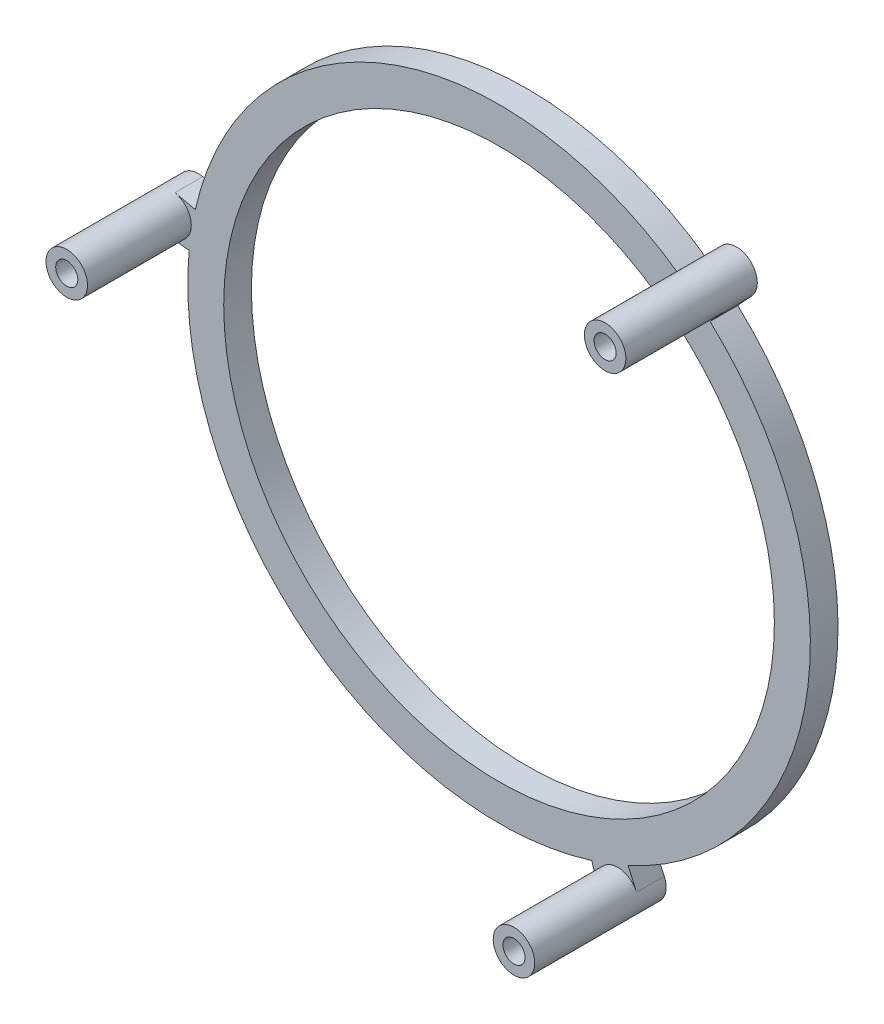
SolidWorks part; units mm, degrees
ref_plane "Front Plane" through (0, 0, 0) normal (0, 0, 1) x (1, 0, 0)
ref_plane "Top Plane" through (0, 0, 0) normal (0, 1, 0) x (1, 0, 0)
ref_plane "Right Plane" through (0, 0, 0) normal (1, 0, 0) x (0, 0, -1)
sketch "Sketch1" plane through (0, 0, 0) normal (0, 0, 1) x (1, 0, 0)
  line L0 (-18.7647, 19.2311) -> (-20.6233, 19.6491)
  line L1 (-19.3285, 15.711) -> (-21.2247, 15.8944)
  line L2 (25.7168, 36.2175) -> (26.8236, 37.768)
  line L3 (28.4833, 33.9693) -> (29.7746, 35.3698)
  line L4 (17.6229, -14.3178) -> (18.1902, -16.1364)
  line L5 (20.9533, -13.0461) -> (21.7426, -14.7799)
  circle A0 centre (9.1138, 12.9608) radius 28.575
  circle A1 centre (9.1138, 12.9608) radius 25.273
  arc A2 (-20.6233, 19.6491) -> (-21.2247, 15.8944) centre (-21.0413, 17.7905) ccw
  arc A3 (26.8236, 37.768) -> (29.7746, 35.3698) centre (28.3741, 36.6611) cw
  arc A4 (18.1902, -16.1364) -> (21.7426, -14.7799) centre (20.0088, -15.5692) ccw
  circle A5 centre (28.3741, 36.6611) radius 1.016
  circle A6 centre (-21.0413, 17.7905) radius 1.016
  circle A7 centre (20.0088, -15.5692) radius 1.016
  dimension "D1" = 1.905
  dimension "D2" = 120
  dimension "D3" = 1.905
  dimension "D6" = 1.905
  dimension "D9" = 1.905
  dimension "D4" = 1.905
  dimension "D5" = 120
  dimension "D7" = 1.905
extrude "Extrude1" add sketch "Sketch1" along normal blind 2.54
sketch "Sketch2" plane through (0, 0, 2.54) normal (0, 0, 1) x (1, 0, 0)
  circle A0 centre (20.0088, -15.5692) radius 1.905
  circle A1 centre (-21.0413, 17.7905) radius 1.905
  circle A2 centre (28.3741, 36.6611) radius 1.905
  circle A3 centre (20.0088, -15.5692) radius 1.016
  circle A4 centre (-21.0413, 17.7905) radius 1.016
  circle A5 centre (28.3741, 36.6611) radius 1.016
extrude "Extrude3" add sketch "Sketch2" along normal blind 9.525
